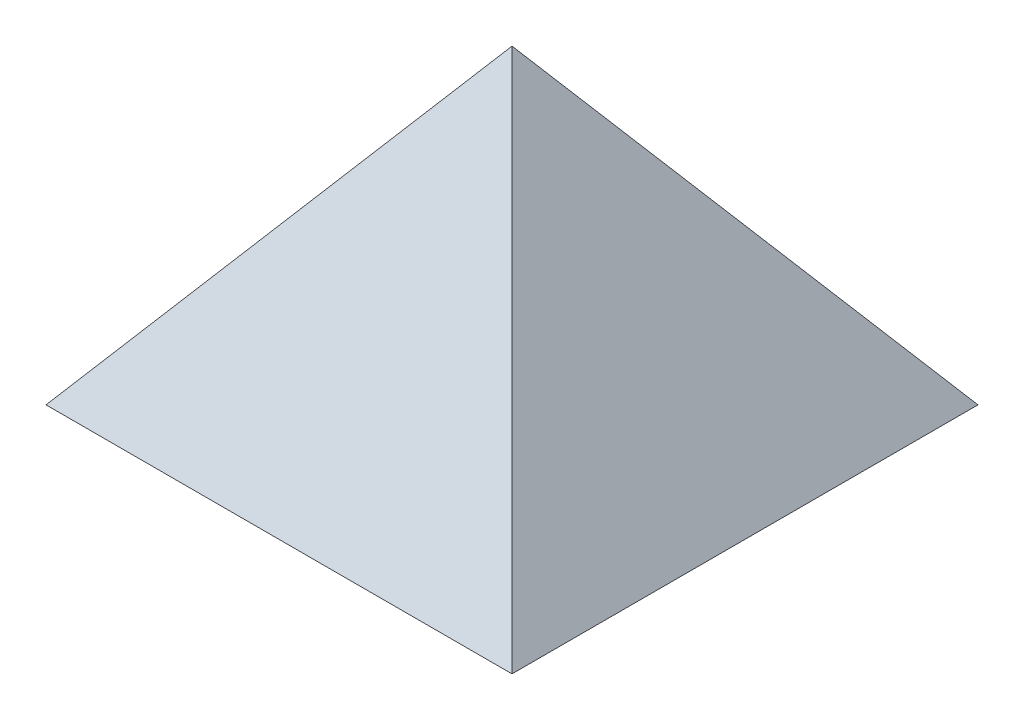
SolidWorks part; units mm, degrees
ref_plane "Front Plane" through (0, 0, 0) normal (0, 0, 1) x (1, 0, 0)
ref_plane "Top Plane" through (0, 0, 0) normal (0, 1, 0) x (1, 0, 0)
ref_plane "Right Plane" through (0, 0, 0) normal (1, 0, 0) x (0, 0, -1)
sketch "Sketch1" plane through (0, 0, 0) normal (0, 1, 0) x (1, 0, 0)
  line L1 (-76.2, -76.2) -> (76.2, -76.2)
  line L2 (-76.2, -76.2) -> (-76.2, 76.2)
  line L3 (-76.2, 76.2) -> (76.2, 76.2)
  line L4 (76.2, -76.2) -> (76.2, 76.2)
  line L5 (-76.2, -76.2) -> (76.2, 76.2) construction
  line L6 (-76.2, 76.2) -> (76.2, -76.2) construction
  point P0 (0, 0)
  dimension "D1" = 152.4
ref_plane "Plane1" through (0, 101.6, 0) normal (0, 1, 0) x (1, 0, 0)
sketch "Sketch2" plane through (0, 101.6, 0) normal (0, 1, 0) x (1, 0, 0)
  point P0 (0, 0)
loft "Loft1" add profiles "Sketch1", "Sketch2"
ref_plane "Plane2" through (0, -50.8, 0) normal (0, 1, 0) x (1, 0, 0)
sketch "Sketch3" plane through (0, -50.8, 0) normal (0, -1, 0) x (1, 0, 0)
  line L0 (0, -62.8618) -> (62.8618, 0)
  line L1 (0, -62.8618) -> (-62.8618, 0)
  line L2 (62.8618, 0) -> (0, 62.8618)
  line L3 (-62.8618, 0) -> (0, 62.8618)
  line L4 (0, -62.8618) -> (0, 62.8618) construction
  line L5 (62.8618, 0) -> (-62.8618, 0) construction
  point P1 (0, 0)
  dimension "D1" = 88.9
extrude "Boss-Extrude1" add sketch "Sketch3" against normal blind 99.06
sketch "Sketch4" plane through (31.4309, 0, 31.4309) normal (0.7071, 0, 0.7071) x (0.7071, 0, -0.7071)
  line L0 (0, 0) -> (0, 101.6) construction
  line L1 (0, 25.4) -> (0, 0) construction
  circle A0 centre (0, 25.4) radius 15.875
  dimension "D1" = 31.75
  dimension "D2" = 25.4
extrude "Cut-Extrude1" cut sketch "Sketch4" against normal through all and the other way through all
sketch "Sketch5" plane through (0, 0, 0) normal (0, 0, 1) x (1, 0, 0)
  circle A0 centre (0, 73.6174) radius 6.8527
extrude "Boss-Extrude2" add sketch "Sketch5" along normal blind 48.26
other "DeleteFace8"
other "DeleteFace9"
other "DeleteFace10"
other "DeleteFace11"
other "DeleteFace12"
other "DeleteFace13"
